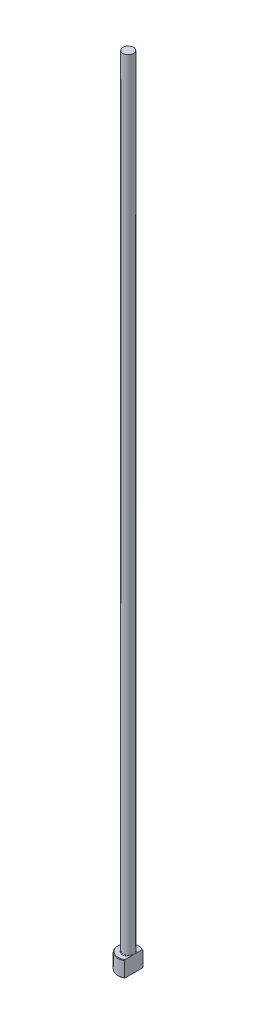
SolidWorks part; units mm, degrees
ref_plane "Front Plane" through (0, 0, 0) normal (0, 0, 1) x (1, 0, 0)
ref_plane "Top Plane" through (0, 0, 0) normal (0, 1, 0) x (1, 0, 0)
ref_plane "Right Plane" through (0, 0, 0) normal (1, 0, 0) x (0, 0, -1)
sketch "Sketch1" plane through (0, 0, 0) normal (0, 0, 1) x (1, 0, 0)
  line L0 (0, 259.9588) -> (0, -15.1925) construction
  line L1 (0, 0) -> (-4, 0)
  line L2 (-4, 0) -> (-4, 6)
  line L3 (-4, 6) -> (-2, 6)
  line L4 (-2, 6) -> (-2, 300)
  line L5 (-2, 300) -> (0, 300)
  line L6 (0, 300) -> (0, 0)
  dimension "L" = 300
  dimension "H" = 8
  dimension "T" = 6
  dimension "D" = 4
revolve "Revolve1" add sketch "Sketch1" angle 360 about L0
chamfer "Chamfer1" distance 0.2 angle 45 2 edges at (0, 6, 4) (0, 0, 4)
fillet "Fillet1" radius 0.2 1 edges at (0, 6, 2)
sketch "Sketch2" plane through (0, 0, 0) normal (0, 1, 0) x (1, 0, 0)
  line L0 (2, -3.4641) -> (2, 3.4641)
  circle A0 centre (0, 0) radius 4 construction
  arc A1 (2, -3.4641) -> (2, 3.4641) centre (0, 0) ccw
  circle A2 centre (0, 0) radius 2 construction
extrude "KEYED HEAD" cut sketch "Sketch2" along normal through all
